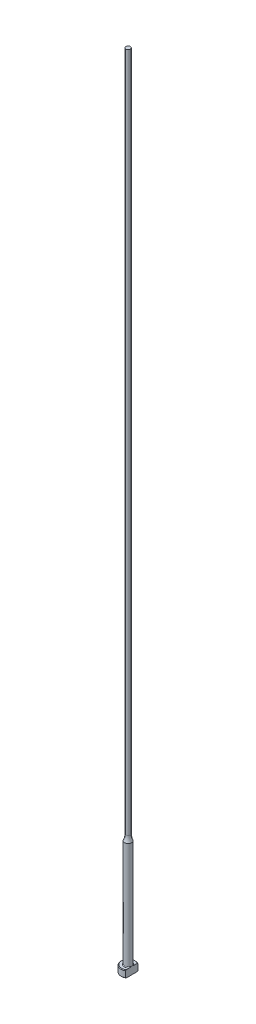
SolidWorks part; units mm, degrees
ref_plane "Front Plane" through (0, 0, 0) normal (0, 0, 1) x (1, 0, 0)
ref_plane "Top Plane" through (0, 0, 0) normal (0, 1, 0) x (1, 0, 0)
ref_plane "Right Plane" through (0, 0, 0) normal (1, 0, 0) x (0, 0, -1)
sketch "Sketch1" plane through (0, 0, 0) normal (0, 0, 1) x (1, 0, 0)
  line L0 (0, 259.9588) -> (0, -15.1925) construction
  line L1 (0, 0) -> (-3.175, 0)
  line L2 (-3.175, 0) -> (-3.175, 3.175)
  line L3 (-3.175, 3.175) -> (-1.5875, 3.175)
  line L4 (-0.9919, 53.4851) -> (-0.9919, 355.6)
  line L5 (-0.9919, 355.6) -> (0, 355.6)
  line L6 (0, 355.6) -> (0, 0)
  line L7 (-1.5875, 3.175) -> (-1.5875, 50.8)
  arc A0 (-1.5875, 50.8) -> (-0.9919, 53.4851) centre (-7.3419, 53.4851) ccw
  point P13 (-1.5875, 0)
  dimension "D1" = 6.35
  dimension "L" = 355.6
  dimension "D2" = 3.175
  dimension "H" = 6.35
  dimension "T" = 3.175
  dimension "D" = 1.9837
  dimension "S" = 50.8
revolve "Revolve1" add sketch "Sketch1" angle 360 about L0
chamfer "Chamfer1" distance 0.254 angle 45 2 edges at (0, 3.175, 3.175) (0, 0, 3.175)
fillet "Fillet1" radius 0.254 1 edges at (0, 3.175, 1.5875)
sketch "Sketch2" plane through (0, 0, 0) normal (0, 1, 0) x (1, 0, 0)
  line L0 (1.5875, -2.7496) -> (1.5875, 2.7496)
  circle A0 centre (0, 0) radius 3.175 construction
  arc A2 (1.5875, -2.7496) -> (1.5875, 2.7496) centre (0, 0) ccw
  circle A3 centre (0, 0) radius 3.175 construction
  circle A4 centre (0, 0) radius 1.5875 construction
extrude "Key Head" cut sketch "Sketch2" along normal up to next
